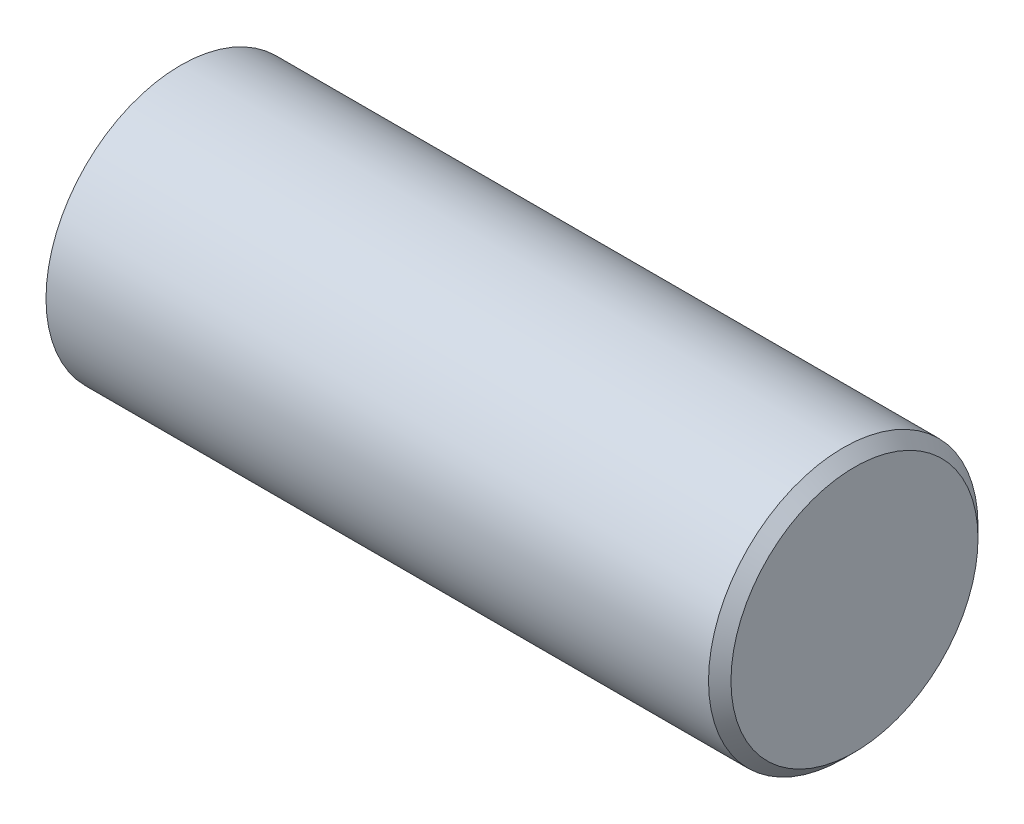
SolidWorks part; units mm, degrees
ref_plane "Plan de face" through (0, 0, 0) normal (0, 0, 1) x (1, 0, 0)
ref_plane "Plan de dessus" through (0, 0, 0) normal (0, 1, 0) x (1, 0, 0)
ref_plane "Plan de droite" through (0, 0, 0) normal (1, 0, 0) x (0, 0, -1)
sketch "Esquisse1" plane through (0, 0, 0) normal (0, 0, 1) x (1, 0, 0)
  line L0 (0, 0) -> (79.2693, 0) construction
  line L2 (0, 0) -> (32, 0)
  line L4 (2, 6) -> (32, 6)
  line L5 (32, 0) -> (32, 6)
  arc A0 (2, 6) -> (0, 0) centre (10, 0) ccw
  dimension "D3" = 10
  dimension "D1" = 12
  dimension "D2" = 32
  dimension "D4" = 2
revolve "Révolution1" add sketch "Esquisse1" angle 360 about L0
chamfer "Chanfrein1" distance 0.5 angle 45 1 edges at (32, 0, 6)
